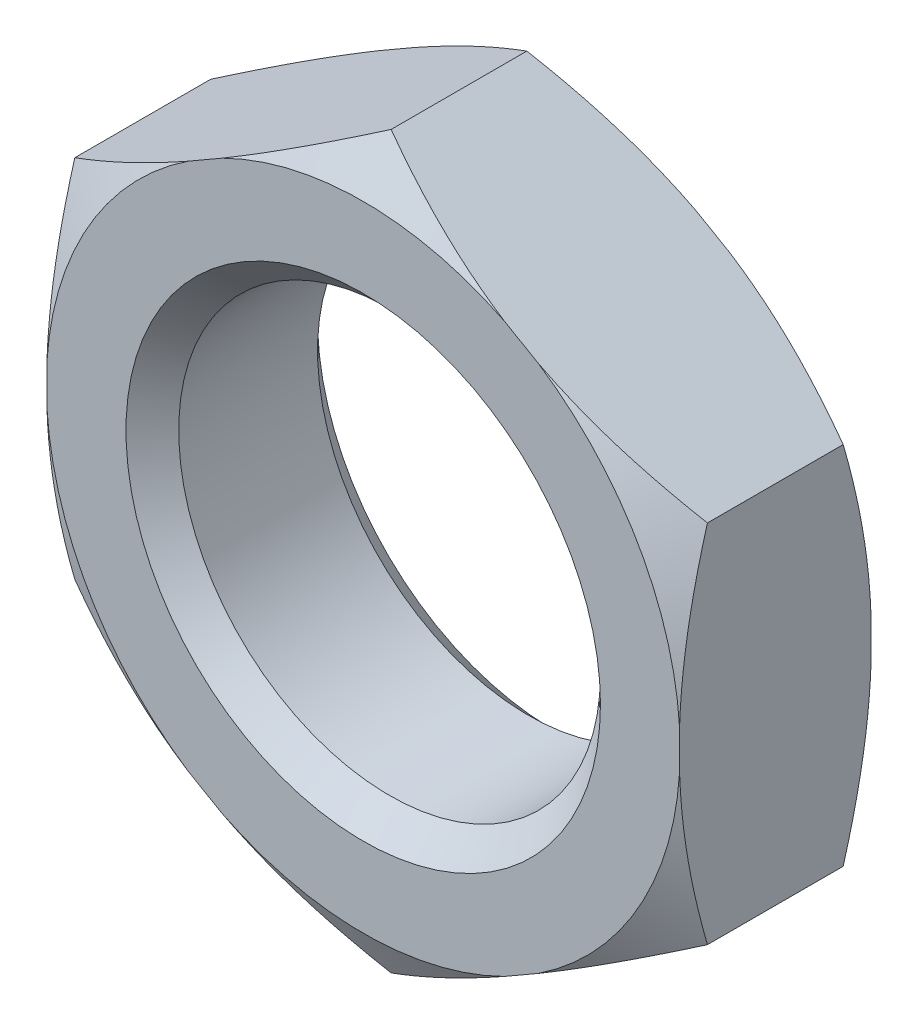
SolidWorks part; units mm, degrees
ref_plane "Front Plane" through (0, 0, 0) normal (0, 0, 1) x (1, 0, 0)
ref_plane "Top Plane" through (0, 0, 0) normal (0, 1, 0) x (1, 0, 0)
ref_plane "Right Plane" through (0, 0, 0) normal (1, 0, 0) x (0, 0, -1)
sketch "Sketch3" plane through (0, 0, 0) normal (0, 0, 1) x (1, 0, 0)
  line L1 (0, 20.7846) -> (-18, 10.3923)
  line L2 (-18, 10.3923) -> (-18, -10.3923)
  line L3 (-18, -10.3923) -> (0, -20.7846)
  line L4 (0, -20.7846) -> (18, -10.3923)
  line L5 (18, -10.3923) -> (18, 10.3923)
  line L6 (18, 10.3923) -> (0, 20.7846)
  circle A0 centre (0, 0) radius 18 construction
  dimension "D1" = 36
extrude "Boss-Extrude1" add sketch "Sketch3" along normal mid plane 10.9
sketch "Sketch4" plane through (0, 0, 0) normal (1, 0, 0) x (0, 0, -1)
  line L0 (-5.4578, 0) -> (6.1545, 0) construction
sketch "Sketch5" plane through (0, 0, 0) normal (1, 0, 0) x (0, 0, -1)
  line L0 (-5.45, 20.7846) -> (-5.45, 18.0346)
  line L1 (-5.45, 10.3923) -> (-5.45, 20.7846) construction
  line L2 (-5.45, 18.0346) -> (-3.8623, 20.7846)
  line L3 (-5.45, 20.7846) -> (5.45, 20.7846) construction
  line L4 (-3.8623, 20.7846) -> (-5.45, 20.7846)
  dimension "D1" = 2.75
  dimension "D2" = 30
revolve "Cut-Revolve1" cut sketch "Sketch5" angle 360 about L0
mirror "Mirror1" about plane through (0, 0, 0) normal (0, 0, 1) of "Cut-Revolve1"
sketch "Sketch6" plane through (0, 0, 5.45) normal (0, 0, 1) x (1, 0, 0)
  circle A0 centre (0, 0) radius 12
  dimension "D1" = 24
extrude "Cut-Extrude1" cut sketch "Sketch6" against normal blind 10.9
chamfer "Chamfer1" distance 1.5 angle 45 2 edges at (12, 0, -5.45) (12, 0, 5.45)
